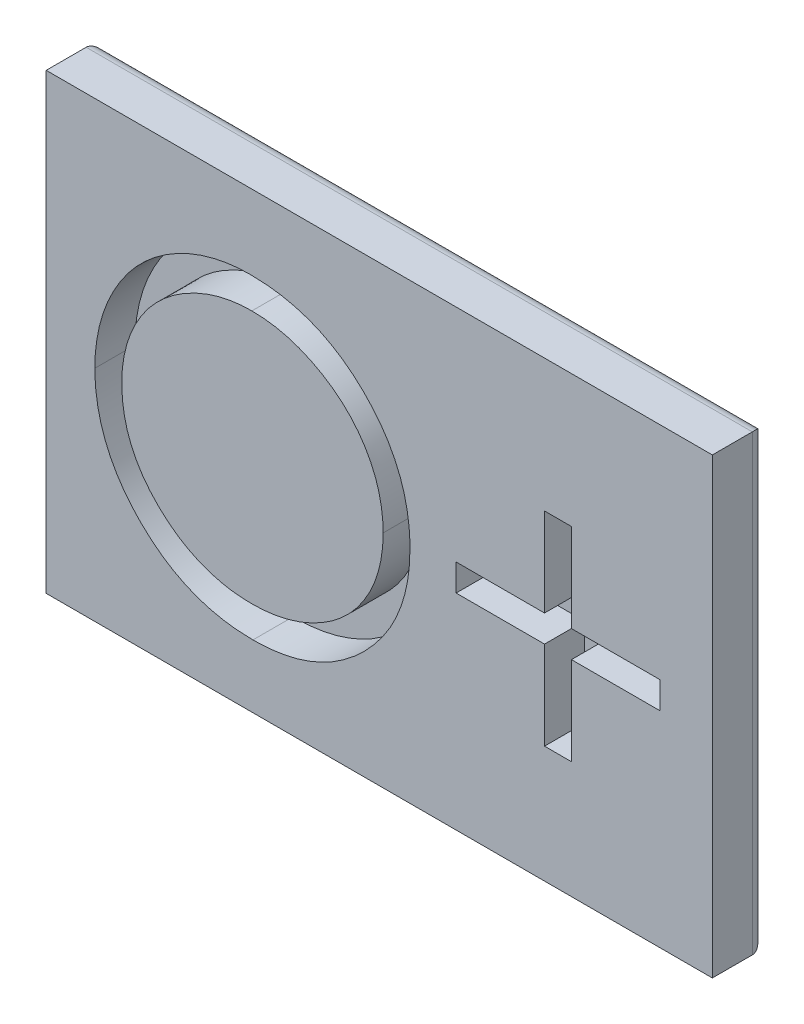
SolidWorks part; units mm, degrees
ref_plane "Front Plane" through (0, 0, 0) normal (0, 0, 1) x (1, 0, 0)
ref_plane "Top Plane" through (0, 0, 0) normal (0, 1, 0) x (1, 0, 0)
ref_plane "Right Plane" through (0, 0, 0) normal (1, 0, 0) x (0, 0, -1)
sketch "Sketch1" plane through (0, 0, 0) normal (0, 0, 1) x (1, 0, 0)
  line L1 (-15.875, -10.795) -> (15.875, -10.795)
  line L2 (-15.875, -10.795) -> (-15.875, 10.795)
  line L3 (-15.875, 10.795) -> (15.875, 10.795)
  line L4 (15.875, -10.795) -> (15.875, 10.795)
  line L5 (-15.875, -10.795) -> (15.875, 10.795) construction
  line L6 (-15.875, 10.795) -> (15.875, -10.795) construction
  point P0 (0, 0)
  dimension "D1" = 31.75
  dimension "D2" = 21.59
extrude "Boss-Extrude1" add sketch "Sketch1" along normal blind 2.54
fillet "Fillet1" radius 0.635 4 edges at (-15.875, 0, 0) (0, -10.795, 0) (0, 10.795, 0) (15.875, 0, 0)
sketch "Sketch2" plane through (0, 0, 2.54) normal (0, 0, 1) x (1, 0, 0)
  line L0 (-15.875, 10.795) -> (-14.977, 9.897) construction
  line L2 (-14.977, 9.897) -> (-14.977, 4.9485) construction
  line L3 (-14.977, 4.9485) -> (-14.977, 0) construction
  line L4 (-14.977, 0) -> (-14.977, -4.9485) construction
  line L5 (-14.977, -4.9485) -> (-14.977, -9.897) construction
  line L6 (-14.977, -9.897) -> (-15.875, -10.795) construction
  line L7 (15.875, 10.795) -> (-15.875, 10.795) construction
  line L8 (-15.875, -10.795) -> (15.875, -10.795) construction
  line L9 (-14.977, 4.9485) -> (14.977, 4.9485) construction
  line L10 (14.977, 4.9485) -> (14.977, 0) construction
  line L11 (14.977, 0) -> (-14.977, 0) construction
  line L12 (14.977, 0) -> (14.977, -4.9485) construction
  line L13 (14.977, -4.9485) -> (-14.977, -4.9485) construction
  line L14 (-14.977, -9.897) -> (14.977, -9.897) construction
  line L15 (14.977, -9.897) -> (14.977, -4.9485) construction
  line L16 (-14.977, 9.897) -> (14.977, 9.897) construction
  line L17 (14.977, 9.897) -> (14.977, 4.9485) construction
  line L18 (14.977, 9.897) -> (15.875, 10.795) construction
  line L19 (14.977, -9.897) -> (15.875, -10.795) construction
  line L20 (-14.977, -7.4227) -> (14.977, -7.4227) construction
  text T0 "O+" font "Century Gothic" height 14.2875
  dimension "D1" = 45
  dimension "D2" = 45
  dimension "D3" = 1.27
extrude "Cut-Extrude1" cut sketch "Sketch2" against normal blind 1.905
